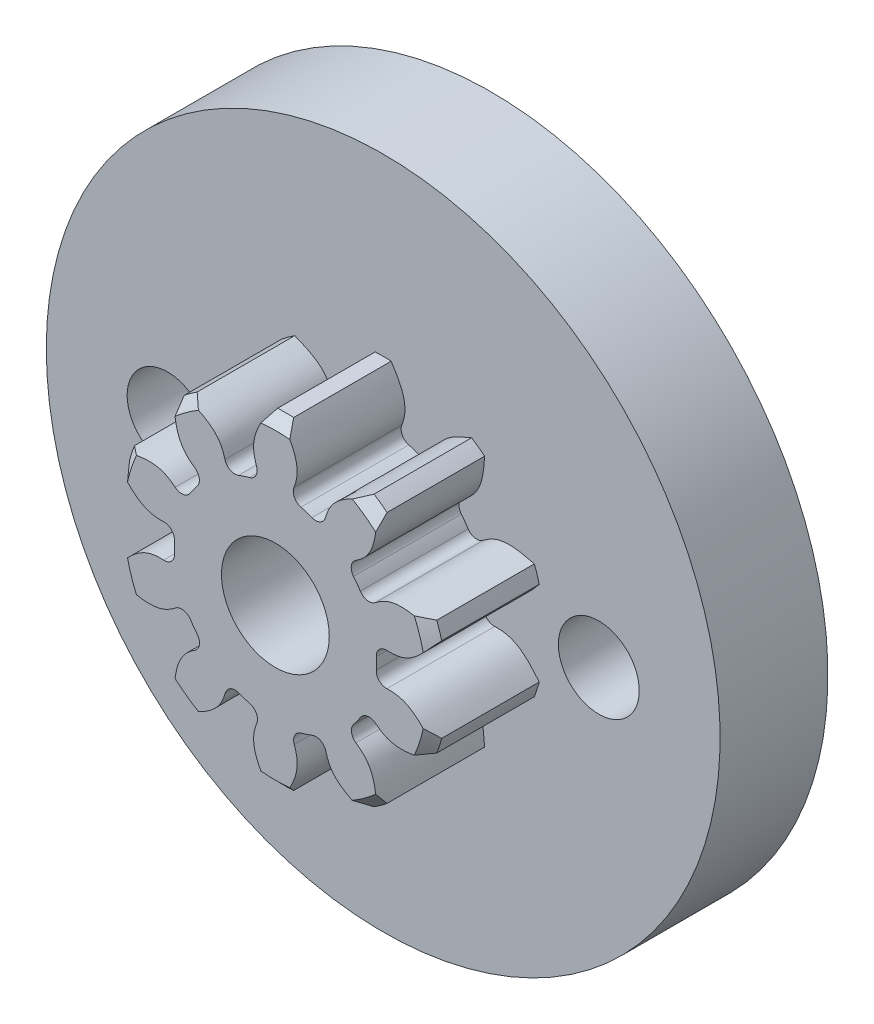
SolidWorks part; units mm, degrees
ref_plane "Plan1" through (0, 0, 0) normal (0, 0, 1) x (1, 0, 0)
ref_plane "Plan2" through (0, 0, 0) normal (0, 1, 0) x (1, 0, 0)
ref_plane "Plan3" through (0, 0, 0) normal (1, 0, 0) x (0, 0, -1)
sketch "Dent" plane through (0, 0, 0) normal (0, 0, 1) x (1, 0, 0)
  line L1 (-0.1488, 1.6323) -> (0, 1.2234)
  line L3 (0, 3) -> (0, -3) construction
  line L4 (0, 0) -> (0.1488, 2.9963) construction
  line L5 (0.3927, 2.469) -> (-0.3927, 2.469) construction
  line L6 (0.4036, 2.3143) -> (-0.4036, 2.3143) construction
  line L7 (-0.25, 0) -> (0.25, 0) construction
  line L9 (0.1488, 1.6323) -> (0, 1.2234)
  line L11 (0, 0) -> (0.3927, 2.469) construction
  line L12 (0, 0) -> (0.4036, 2.3143) construction
  circle A0 centre (0, 0) radius 2.5 construction
  circle A1 centre (0, 0) radius 3 construction
  arc A2 (0.1488, 2.9963) -> (-0.1488, 2.9963) centre (0, 0) ccw
  circle A3 centre (0, 0) radius 2.3492 construction
  point P2 (-0.3927, 2.469)
  point P3 (-0.4036, 2.3143)
  point P19 (0.3927, 2.469)
  point P20 (0.4036, 2.3143)
sketch "Esquisse2" plane through (0, 0, 0) normal (0, 0, 1) x (1, 0, 0)
  circle A0 centre (0, 0) radius 1.875
extrude "Base-Extrusion" add sketch "Esquisse2" against normal blind 2
extrude "Boss.-Extru.1" add sketch "Dent" against normal blind 2
fillet "Congé1" radius 0.19 4 edges at (0.2498, 1.8583, -1) (-0.2591, 1.857, -1)
chamfer "Chanfrein1" distance 0.19 angle 45 2 edges at (0, 3, 0)
pattern_circular "Répétition circulaire1" count 10 over 360 of "Congé1", "Boss.-Extru.1", "Chanfrein1"
sketch "Esquisse3" plane through (0, 0, -2) normal (0, 0, -1) x (-1, 0, 0)
  circle A0 centre (0, 0) radius 6.25
  dimension "D1" = 12.5
extrude "Extrusion1" add sketch "Esquisse3" along normal blind 2
sketch "Esquisse4" plane through (0, 0, -4) normal (0, 0, -1) x (-1, 0, 0)
  line L0 (-7.0626, 0) -> (8.0079, 0) construction
  circle A0 centre (-4, 0) radius 0.75
  circle A1 centre (4, 0) radius 0.75
  dimension "D1" = 1.5
  dimension "D2" = 4
  dimension "D3" = 4
extrude "Enlèv. mat.-Extru.1" cut sketch "Esquisse4" against normal through all
sketch "Esquisse5" plane through (0, 0, 0) normal (0, 0, 1) x (1, 0, 0)
  circle A0 centre (0, 0) radius 1
  dimension "D1" = 2
extrude "Enlèv. mat.-Extru.2" cut sketch "Esquisse5" against normal through all
equation "\"Dp@Dent\" = \"Module@Dent\"*\"Nbr de dents@Répétition circulaire1\" "
equation "\"Dt@Dent\" = \"Module@Dent\"*(\"Nbr de dents@Répétition circulaire1\"+2)"
equation "\"Dpied@Esquisse2\" = \"Dp@Dent\"-(2.5*\"Module@Dent\")"
equation "\"Db@Dent\" = \"Dp@Dent\"*cos(\"Angle de pression@Dent\"*pi/180)"
equation "\"Ep au primitif@Dent\" =  (pi*\"Dp@Dent\"/2)/\"Nbr de dents@Répétition circulaire1\""
equation "\"D3@Dent\"=atn((Sin((sqr(((\"Dt@Dent\"/\"Db@Dent\")^2)-1))) -((sqr(((\"Dt@Dent\"/\"Db@Dent\")^2)-1)) * Cos((sqr(((\"Dt@Dent\"/\"Db@Dent\")^2)-1)))))/(Cos((sqr(((\"Dt@Dent\"/\"Db@Dent\")^2)-1))) +((sqr(((\"Dt@Dent\"/\"Db@"
equation "\"D4@Dent\"=atn((Sin((sqr(((\"Dp@Dent\"/\"Db@Dent\")^2)-1))) -((sqr(((\"Dp@Dent\"/\"Db@Dent\")^2)-1)) * Cos((sqr(((\"Dp@Dent\"/\"Db@Dent\")^2)-1)))))/(Cos((sqr(((\"Dp@Dent\"/\"Db@Dent\")^2)-1))) +((sqr(((\"Dp@Dent\"/\"Db@"
equation "\"D1@Congé1\" = \"Module@Dent\"*0.38"
equation "\"D1@Chanfrein1\" = \"Module@Dent\"*0.38"
equation "\"D1@Base-Extrusion\" = \"Epaisseur@Boss.-Extru.1\""
